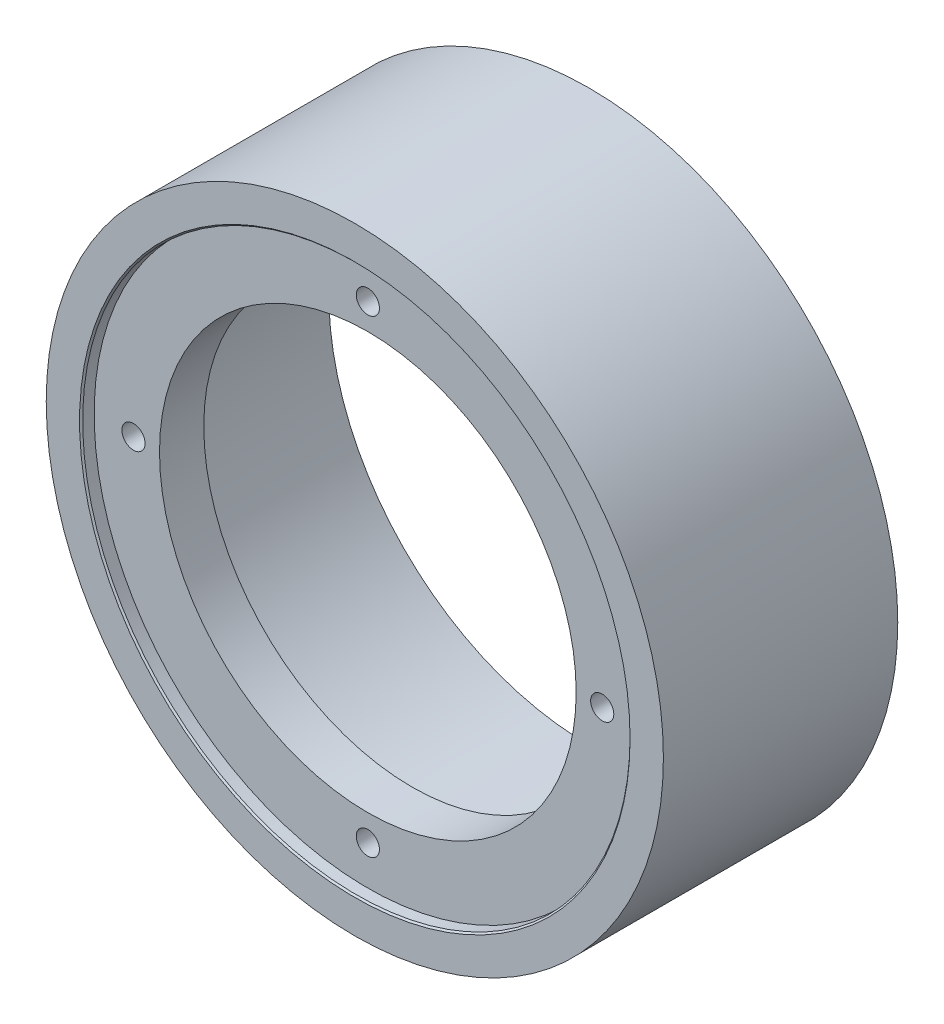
SolidWorks part; units mm, degrees
ref_plane "Front" through (0, 0, 0) normal (0, 0, 1) x (1, 0, 0)
ref_plane "Top" through (0, 0, 0) normal (0, 1, 0) x (1, 0, 0)
ref_plane "Right" through (0, 0, 0) normal (1, 0, 0) x (0, 0, -1)
sketch "Sketch1" plane through (0, 0, 0) normal (0, 0, 1) x (1, 0, 0)
  circle A0 centre (0, 0) radius 25.4
  circle A1 centre (0, 0) radius 30.099
  dimension "D1" = 50.8
  dimension "D2" = 60.198
extrude "Extrude1" add sketch "Sketch1" along normal blind 22.86
sketch "Sketch2" plane through (0, 0, 22.86) normal (0, 0, 1) x (1, 0, 0)
  circle A0 centre (0, 0) radius 20.32
  circle A1 centre (0, 0) radius 30.099
  circle A2 centre (0, 0) radius 30.099 construction
  circle A3 centre (0, 0) radius 25.4 construction
  dimension "D1" = 40.64
extrude "Extrude2" add sketch "Sketch2" against normal blind 5.588
sketch "Sketch3" plane through (0, 0, 22.86) normal (0, 0, 1) x (1, 0, 0)
  circle A0 centre (0, 0) radius 26.6954
  dimension "D1" = 53.3908
extrude "Cut-Extrude1" cut sketch "Sketch3" against normal blind 1.27
hole_wizard "#4-40 Tapped Hole3" positions "Sketch7" profile "Sketch6" tap size "#4-40" standard "Ansi Inch"
sketch "Sketch7" plane through (0, 0, 21.59) normal (0, 0, 1) x (1, 0, 0)
  circle A1 centre (0, 22.86) radius 1.4732 construction
  point P1 (0, 22.86)
sketch "Sketch6" plane through (0, 22.86, 21.59) normal (1, 0, 0) x (0, -1, 0)
  line L0 (0, 0) -> (0, 21.59)
  line L1 (0, 21.59) -> (1.1303, 21.59)
  line L2 (1.1303, 21.59) -> (1.1303, 0)
  line L5 (1.1303, 0) -> (0, 0)
  line L11 (0, -6.35) -> (0, 107.95) construction
  dimension "Thru Tap Drill Dia." = 2.2606
  dimension "Thru Tap Drill Depth" = 21.59
pattern_circular "CirPattern1" count 4 over 360 about axis through (0, 0, 0) along (0, 0, 1) of "#4-40 Tapped Hole3"
chamfer "Chamfer1" distance 0.1524 angle 45 1 edges at (26.6954, 0, 22.86)
